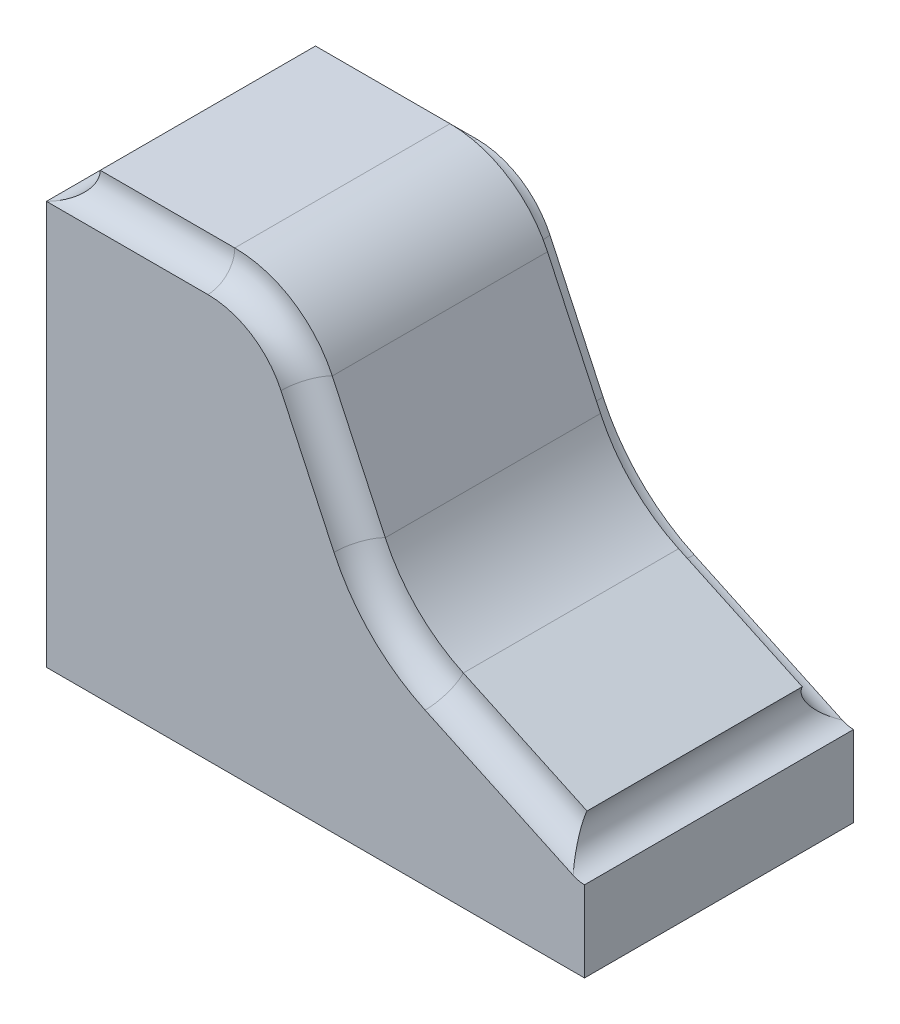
SolidWorks part; units mm, degrees
ref_plane "Front Plane" through (0, 0, 0) normal (0, 0, 1) x (1, 0, 0)
ref_plane "Top Plane" through (0, 0, 0) normal (0, 1, 0) x (1, 0, 0)
ref_plane "Right Plane" through (0, 0, 0) normal (1, 0, 0) x (0, 0, -1)
sketch "Sketch1" plane through (0, 0, 0) normal (0, 0, 1) x (1, 0, 0)
  line L0 (0, 0) -> (0, 101.6)
  line L1 (0, 0) -> (127, 0)
  line L2 (127, 0) -> (127, 25.4)
  line L3 (127, 25.4) -> (92.0497, 41.6976)
  line L4 (73.6212, 60.1261) -> (61.1202, 86.9345)
  line L5 (38.1, 101.6) -> (0, 101.6)
  arc A0 (92.0497, 41.6976) -> (73.6212, 60.1261) centre (108.1515, 76.2279) cw
  arc A1 (61.1202, 86.9345) -> (38.1, 101.6) centre (38.1, 76.2) ccw
  dimension "D3" = 38.1
  dimension "D4" = 25.4
  dimension "D1" = 127
  dimension "D2" = 101.6
  dimension "D5" = 25
  dimension "D6" = 25.4
  dimension "D7" = 38.1
  dimension "D8" = 25
extrude "Boss-Extrude1" add sketch "Sketch1" along normal blind 63.5
sweep "Cut-Sweep1" cut parameters "D3"=12.7
